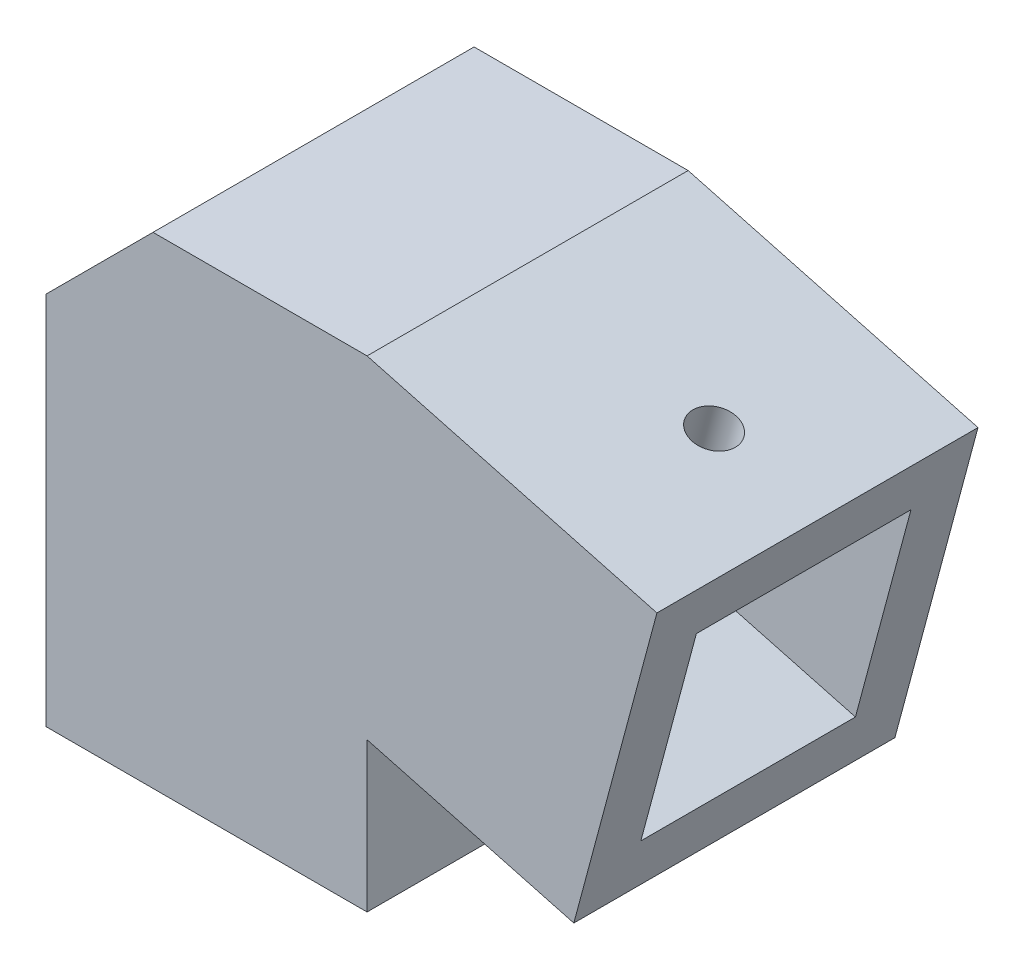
SolidWorks part; units mm, degrees
ref_plane "Alzado" through (0, 0, 0) normal (0, 0, 1) x (1, 0, 0)
ref_plane "Planta" through (0, 0, 0) normal (0, 1, 0) x (1, 0, 0)
ref_plane "Vista lateral" through (0, 0, 0) normal (1, 0, 0) x (0, 0, -1)
sketch "Croquis2" plane through (0, 0, 0) normal (0, 1, 0) x (1, 0, 0)
  line L1 (-15, -15) -> (15, -15)
  line L2 (-15, -15) -> (-15, 15)
  line L3 (-15, 15) -> (15, 15)
  line L4 (15, -15) -> (15, 15)
  line L5 (-15, -15) -> (15, 15) construction
  line L6 (-15, 15) -> (15, -15) construction
  point P0 (0, 0)
  dimension "D1" = 30
  dimension "D2" = 30
extrude "Saliente-Extruir1" add sketch "Croquis2" along normal blind 20 and the other way blind 25
sketch "Croquis3" plane through (0, 0, 15) normal (0, 0, 1) x (1, 0, 0)
  line L0 (15, 20) -> (42.0831, 12.7431)
  line L1 (15, -25) -> (15, 20) construction
  line L4 (15, -11.0583) -> (15, 20)
  line L5 (15, -11.0583) -> (34.3185, -16.2347)
  line L6 (34.3185, -16.2347) -> (42.0831, 12.7431)
  dimension "D1" = 75
  dimension "D2" = 90
  dimension "D3" = 20
  dimension "D4" = 30
extrude "Saliente-Extruir2" add sketch "Croquis3" against normal up to surface (30 mm away)
sketch "Croquis4" plane through (0, -25, 0) normal (0, -1, 0) x (1, 0, 0)
  line L1 (-10.025, -10.025) -> (10.025, -10.025)
  line L2 (-10.025, -10.025) -> (-10.025, 10.025)
  line L3 (-10.025, 10.025) -> (10.025, 10.025)
  line L4 (10.025, -10.025) -> (10.025, 10.025)
  line L5 (-10.025, -10.025) -> (10.025, 10.025) construction
  line L6 (-10.025, 10.025) -> (10.025, -10.025) construction
  point P0 (0, 0)
  dimension "D1" = 20.05
  dimension "D2" = 20.05
extrude "Cortar-Extruir1" cut sketch "Croquis4" against normal blind 20
sketch "Croquis5" plane through (36.0783, -9.6671, 0) normal (0.9659, -0.2588, 0) x (0, 0, -1)
  line L0 (15, 23.2008) -> (-15, 23.2008) construction
  line L6 (-10.025, -1.8242) -> (10.025, -1.8242)
  line L8 (-10.025, -1.8242) -> (-10.025, 18.2258)
  line L9 (-10.025, 18.2258) -> (10.025, 18.2258)
  line L10 (10.025, -1.8242) -> (10.025, 18.2258)
  line L11 (-10.025, -1.8242) -> (10.025, 18.2258) construction
  line L12 (-10.025, 18.2258) -> (10.025, -1.8242) construction
  point P0 (0, 8.2008)
  dimension "D1" = 20.05
  dimension "D2" = 20.05
  dimension "D3" = 15
extrude "Cortar-Extruir2" cut sketch "Croquis5" along a picked direction on the side against the normal blind 22
chamfer "Chaflán1" distance 10 angle 45 1 edges at (-15, 20, 0)
sketch "Croquis6" plane through (6.0048, 22.4103, 0) normal (0.2588, 0.9659, 0) x (0, 0, -1)
  line L0 (15, -37.351) -> (-15, -37.351) construction
  circle A0 centre (0, -27.351) radius 2.05
  dimension "D1" = 4.1
  dimension "D2" = 10
extrude "Cortar-Extruir3" cut sketch "Croquis6" against normal up to surface (4.975 mm away) contours A0
sketch "Croquis7" plane through (-15, 0, 0) normal (-1, 0, 0) x (0, 0, 1)
  line L0 (-15, -25) -> (15, -25) construction
  circle A0 centre (0, -15) radius 2.05
  dimension "D1" = 4.1
  dimension "D2" = 10
extrude "Cortar-Extruir4" cut sketch "Croquis7" against normal up to surface (4.975 mm away)
